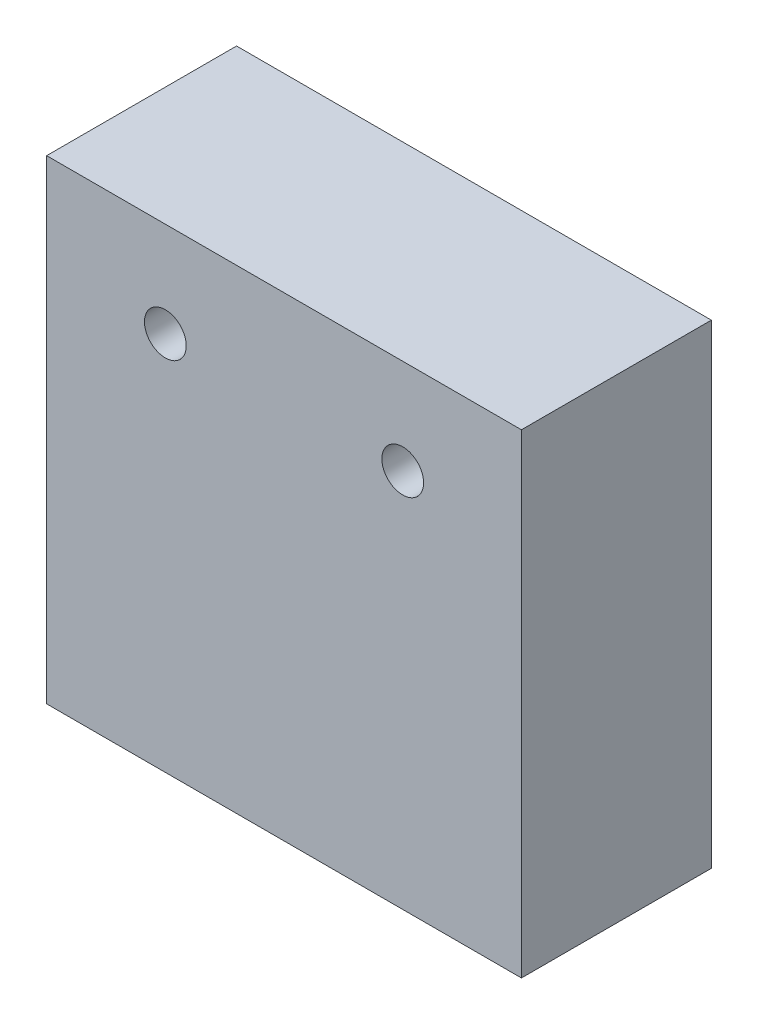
SolidWorks part; units mm, degrees
ref_plane "Front Plane" through (0, 0, 0) normal (0, 0, 1) x (1, 0, 0)
ref_plane "Top Plane" through (0, 0, 0) normal (0, 1, 0) x (1, 0, 0)
ref_plane "Right Plane" through (0, 0, 0) normal (1, 0, 0) x (0, 0, -1)
sketch "Sketch1" plane through (0, 0, 0) normal (0, 0, 1) x (1, 0, 0)
  line L0 (0, 0) -> (0, 26.8921) construction
  line L1 (0, 0) -> (15.875, 0)
  line L2 (15.875, 0) -> (15.875, 31.75)
  line L3 (15.875, 31.75) -> (-15.875, 31.75)
  line L4 (-15.875, 31.75) -> (-15.875, 0)
  line L5 (-15.875, 0) -> (0, 0)
  line L6 (-9.525, 0) -> (-9.525, 11.6811) construction
  line L7 (9.525, 0) -> (9.525, 11.6811) construction
  circle A0 centre (-7.9375, 25.4) radius 1.397
  circle A1 centre (7.9375, 25.4) radius 1.397
  dimension "D3" = 2.794
  dimension "D1" = 31.75
  dimension "D2" = 31.75
  dimension "D4" = 6.35
  dimension "D5" = 15.875
  dimension "D6" = 19.05
sketch "Sketch2" plane through (0, 0, 0) normal (0, 0, 1) x (1, 0, 0)
  line L0 (-15.875, 31.75) -> (-15.875, 0) construction
  line L1 (-15.875, 0) -> (0, 0) construction
  line L2 (0, 0) -> (15.875, 0) construction
  line L3 (15.875, 0) -> (15.875, 31.75) construction
  line L4 (15.875, 31.75) -> (-15.875, 31.75) construction
  line L5 (-15.875, 31.75) -> (-15.875, 0)
  line L6 (-15.875, 0) -> (0, 0)
  line L7 (0, 0) -> (15.875, 0)
  line L8 (15.875, 0) -> (15.875, 31.75)
  line L9 (15.875, 31.75) -> (-15.875, 31.75)
  circle A0 centre (-7.9375, 25.4) radius 1.397 construction
  circle A1 centre (7.9375, 25.4) radius 1.397 construction
  circle A2 centre (-7.9375, 25.4) radius 1.397
  circle A3 centre (7.9375, 25.4) radius 1.397
extrude "Boss-Extrude1" add sketch "Sketch2" along normal mid plane 12.7
hole_wizard "1/4 (0.25) Diameter Hole1" positions "Sketch4" profile "Sketch3" hole size "1/4" standard "ANSI Inch"
sketch "Sketch4" plane through (0, 0, 0) normal (0, -1, 0) x (-1, 0, 0)
  point P0 (9.525, 0)
  point P3 (-9.525, 0)
sketch "Sketch3" plane through (-9.525, 0, 0) normal (1, 0, 0) x (0, 0, -1)
  line L0 (0, 0) -> (0, 22.2277)
  line L1 (0, 22.2277) -> (3.175, 20.32)
  line L2 (3.175, 20.32) -> (3.175, 0)
  line L5 (3.175, 0) -> (0, 0)
  line L10 (0, 22.2277) -> (-3.175, 20.32) construction
  line L11 (0, -6.35) -> (0, 107.95) construction
  dimension "Hole Dia." = 6.35
  dimension "Hole Depth" = 20.32
  dimension "Drill Angle" = 118
